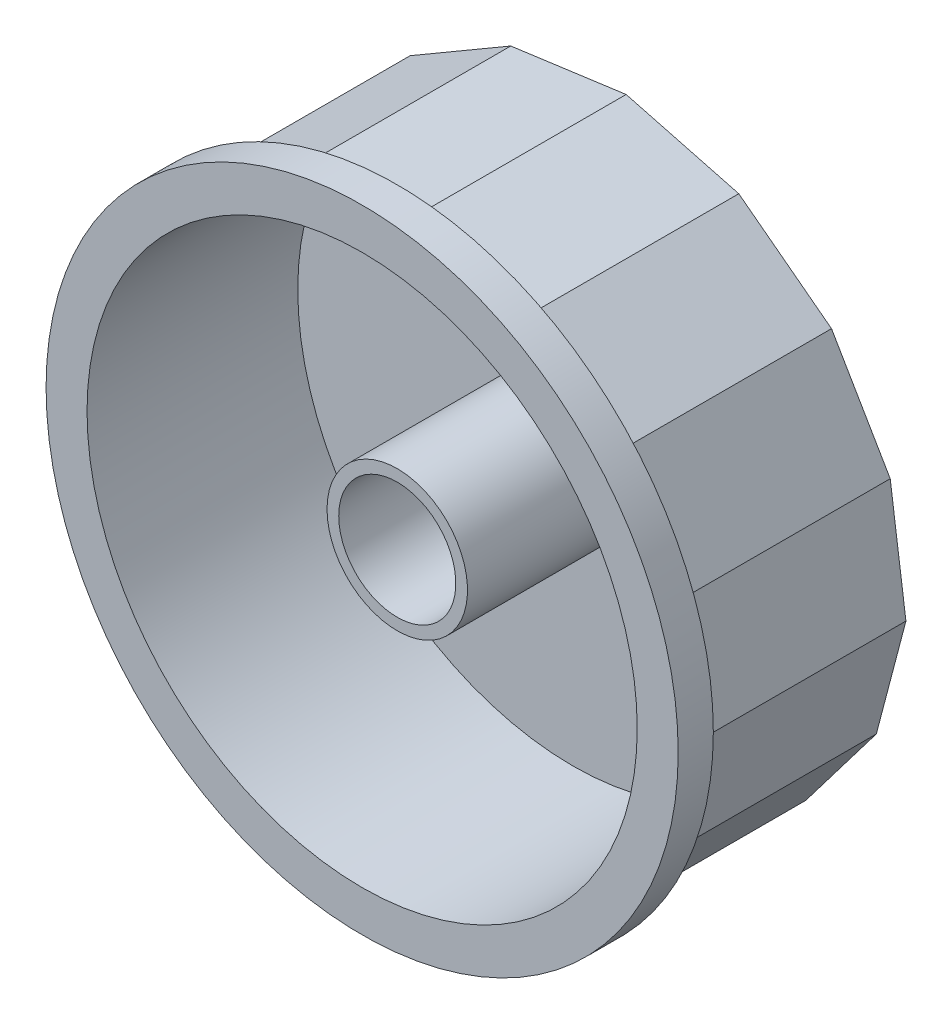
SolidWorks part; units mm, degrees
ref_plane "Alzado" through (0, 0, 0) normal (0, 0, 1) x (1, 0, 0)
ref_plane "Planta" through (0, 0, 0) normal (0, 1, 0) x (1, 0, 0)
ref_plane "Vista lateral" through (0, 0, 0) normal (1, 0, 0) x (0, 0, -1)
sketch "Croquis1" plane through (0, 0, 0) normal (0, 0, 1) x (1, 0, 0)
  circle A0 centre (0, 0) radius 25.5
  dimension "D1" = 51
extrude "Saliente-Extruir1" add sketch "Croquis1" along normal blind 18
sketch "Croquis2" plane through (0, 0, 18) normal (0, 0, 1) x (1, 0, 0)
  circle A0 centre (0, 0) radius 27
  dimension "D1" = 54
extrude "Saliente-Extruir2" add sketch "Croquis2" along normal blind 3
sketch "Croquis3" plane through (0, 0, 0) normal (0, 0, -1) x (-1, 0, 0)
  line L0 (0, -27) -> (0, 27) construction
  line L1 (0.2247, -25.4553) -> (0.2247, -26.7477)
  line L2 (0.2247, -26.7477) -> (-0.2905, -26.7477)
  line L3 (-0.2905, -26.7477) -> (-0.2905, -25.4983)
  circle A0 centre (0, 0) radius 27 construction
  circle A1 centre (0, 0) radius 25.5 construction
sketch "Croquis4" plane through (0, 0, 0) normal (0, 0, -1) x (-1, 0, 0)
  line L1 (24.1093, -8.306) -> (25.4527, 1.5525)
  line L2 (25.4527, 1.5525) -> (22.9211, 11.1746)
  line L3 (22.9211, 11.1746) -> (16.9, 19.0955)
  line L4 (16.9, 19.0955) -> (8.306, 24.1093)
  line L5 (8.306, 24.1093) -> (-1.5525, 25.4527)
  line L6 (-1.5525, 25.4527) -> (-11.1746, 22.9211)
  line L7 (-11.1746, 22.9211) -> (-19.0955, 16.9)
  line L8 (-19.0955, 16.9) -> (-24.1093, 8.306)
  line L9 (-24.1093, 8.306) -> (-25.4527, -1.5525)
  line L10 (-25.4527, -1.5525) -> (-22.9211, -11.1746)
  line L11 (-22.9211, -11.1746) -> (-16.9, -19.0955)
  line L12 (-16.9, -19.0955) -> (-8.306, -24.1093)
  line L13 (-8.306, -24.1093) -> (1.5525, -25.4527)
  line L14 (1.5525, -25.4527) -> (11.1746, -22.9211)
  line L15 (11.1746, -22.9211) -> (19.0955, -16.9)
  line L16 (19.0955, -16.9) -> (24.1093, -8.306)
  circle A0 centre (0, 0) radius 25.01 construction
  circle A1 centre (0, 0) radius 25.5
extrude "Cortar-Extruir1" cut sketch "Croquis4" against normal blind 18 contours L8 M2 | L7 M2 | L6 M2 | L5 M2 | L4 M2 | L3 M2 | L2 M2 | L1 M2 | L16 M2 | L15 M2 | L14 M2 | L13 M2 | L12 M2 | L11 M2 | L10 M2 | L9 M2
sketch "Croquis6" plane through (0, 0, 21) normal (0, 0, 1) x (1, 0, 0)
  circle A0 centre (0, 0) radius 23.5
  dimension "D1" = 47
extrude "Cortar-Extruir3" cut sketch "Croquis6" against normal blind 18
sketch "Croquis7" plane through (0, 0, 0) normal (0, 0, -1) x (-1, 0, 0)
  circle A0 centre (0, 0) radius 5
  dimension "D1" = 10
extrude "Cortar-Extruir4" cut sketch "Croquis7" against normal through all
sketch "Croquis8" plane through (0, 0, 0) normal (0, 0, -1) x (-1, 0, 0)
  circle A0 centre (0, 0) radius 6
  dimension "D1" = 12
extrude "Saliente-Extruir3" add sketch "Croquis8" along normal blind 12 and the other way blind 18
sketch "Croquis9" plane through (0, 0, -12) normal (0, 0, -1) x (-1, 0, 0)
  circle A0 centre (0, 0) radius 5
  dimension "D1" = 10
extrude "Cortar-Extruir5" cut sketch "Croquis9" against normal through all both and the other way through all
sketch "Croquis10" plane through (0, 0, 0) normal (0, 0, -1) x (-1, 0, 0)
  circle A0 centre (0, 0) radius 11
  circle A1 centre (0, 0) radius 6
  dimension "D1" = 22
extrude "Cortar-Extruir6" cut sketch "Croquis10" against normal blind 1
